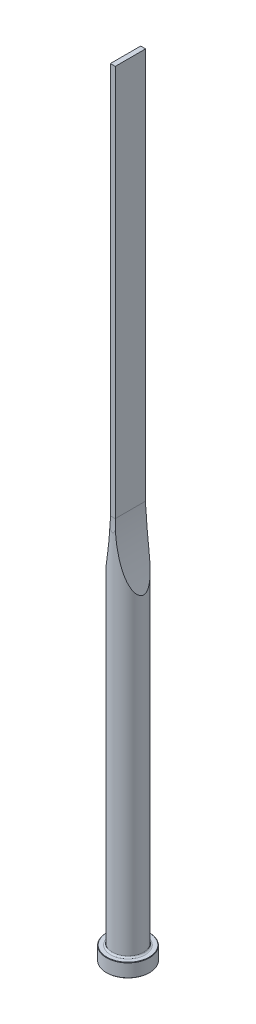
SolidWorks part; units mm, degrees
ref_plane "Front Plane" through (0, 0, 0) normal (0, 0, 1) x (1, 0, 0)
ref_plane "Top Plane" through (0, 0, 0) normal (0, 1, 0) x (1, 0, 0)
ref_plane "Right Plane" through (0, 0, 0) normal (1, 0, 0) x (0, 0, -1)
sketch "Sketch1" plane through (0, 0, 0) normal (0, 0, 1) x (1, 0, 0)
  line L0 (0, 0) -> (10.8, 0)
  line L1 (55, 0) -> (-55, 0) construction
  line L2 (11, 0.2) -> (11, 6.8)
  line L3 (10.8, 7) -> (8.8, 7)
  line L4 (8, 7.8) -> (8, 400)
  line L5 (0, 400) -> (8, 400)
  line L6 (11, 6.8) -> (10.8, 7)
  line L7 (10.8, 0) -> (11, 0.2)
  line L8 (0, 400) -> (0, 0)
  arc A0 (8, 7.8) -> (8.8, 7) centre (8.8, 7.8) ccw
  point P1 (11, 0)
  point P6 (11, 7)
  dimension "D4" = 0.8
  dimension "D1" = 8
  dimension "D2" = 11
  dimension "D3" = 7
  dimension "D5" = 400
revolve "Revolve1" add sketch "Sketch1" angle 360 about L8
sketch "Sketch2" plane through (0, 0, 0) normal (0, 0, 1) x (1, 0, 0)
  line L0 (1.25, 400) -> (1.25, 200)
  line L1 (8, 400) -> (-8, 400) construction
  line L2 (-1.25, 400) -> (-1.25, 200)
  line L3 (8, 400) -> (8, 165.803)
  line L4 (-8, 400) -> (-8, 165.803)
  line L5 (0, -12.1) -> (0, 12.1) construction
  line L6 (8, 400) -> (1.25, 400)
  line L8 (-1.25, 400) -> (-8, 400)
  arc A0 (1.25, 200) -> (8, 165.803) centre (91.25, 200) ccw
  arc A1 (-1.25, 200) -> (-8, 165.803) centre (-91.25, 200) cw
  dimension "D4" = 90
  dimension "D1" = 200
  dimension "D2" = 2.5
  dimension "D3" = 1.25
extrude "Cut-Extrude1" cut sketch "Sketch2" against normal mid plane 20
sketch "Sketch3" plane through (0, 0, 0) normal (1, 0, 0) x (0, 0, -1)
  line L0 (7.75, 400) -> (7.75, 200)
  line L1 (-7.9017, 400) -> (7.9017, 400) construction
  line L2 (-7.75, 400) -> (-7.75, 200)
  line L3 (8, 400) -> (8, 193.2965)
  line L4 (7.75, 400) -> (8, 400)
  line L5 (0, 12.1) -> (0, -12.1) construction
  line L6 (-8, 400) -> (-8, 193.2965)
  line L8 (-7.75, 400) -> (-8, 400)
  arc A0 (7.75, 200) -> (8, 193.2965) centre (97.75, 200) ccw
  arc A1 (-7.75, 200) -> (-8, 193.2965) centre (-97.75, 200) cw
  dimension "D2" = 90
  dimension "D1" = 200
  dimension "D3" = 15.5
  dimension "D4" = 7.75
extrude "Cut-Extrude2" cut sketch "Sketch3" against normal mid plane 20
